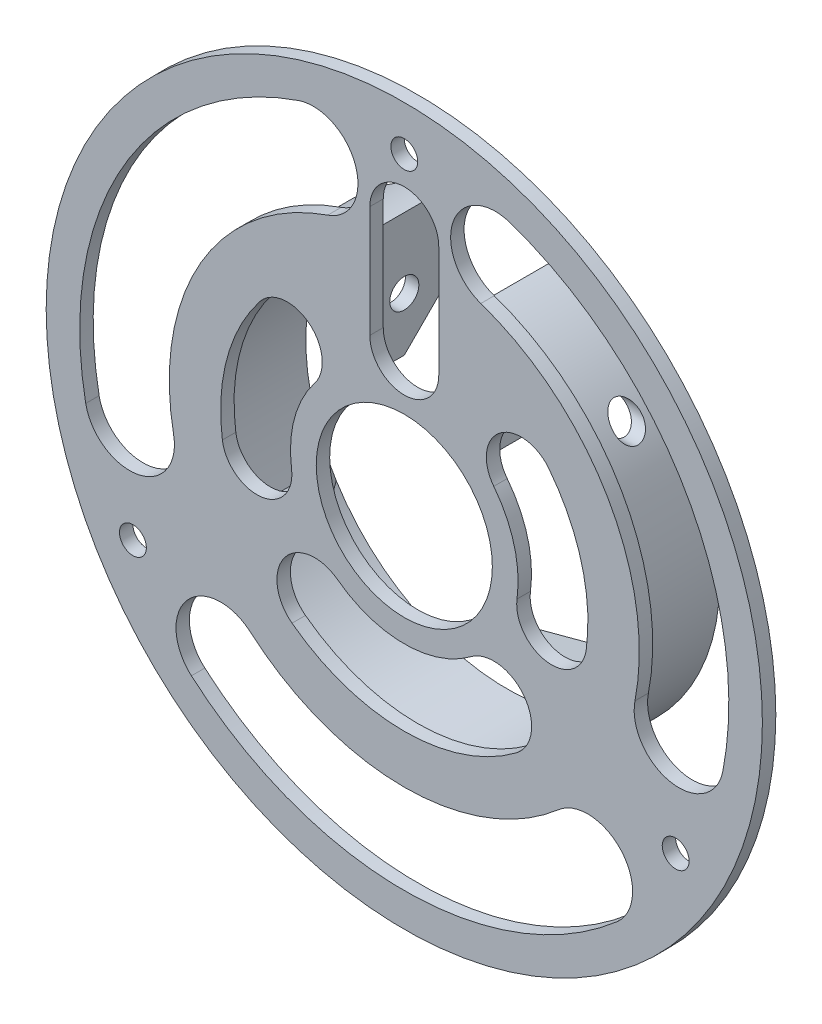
SolidWorks part; units mm, degrees
ref_plane "Plan de face" through (0, 0, 0) normal (0, 0, 1) x (1, 0, 0)
ref_plane "Plan de dessus" through (0, 0, 0) normal (0, 1, 0) x (1, 0, 0)
ref_plane "Plan de droite" through (0, 0, 0) normal (1, 0, 0) x (0, 0, -1)
sketch "Esquisse1" plane through (0, 0, 0) normal (0, 0, 1) x (1, 0, 0)
  circle A0 centre (0, 0) radius 47.5
  circle A1 centre (0, 0) radius 45
  dimension "D1" = 95
  dimension "D2" = 90
extrude "Boss.-Extru.1" add sketch "Esquisse1" along normal blind 20
sketch "Esquisse2" plane through (0, 0, 20) normal (0, 0, 1) x (1, 0, 0)
  circle A0 centre (0, 0) radius 80
  dimension "D1" = 160
extrude "Boss.-Extru.2" add sketch "Esquisse2" along normal blind 3
sketch "Esquisse3" plane through (0, 0, 20) normal (0, 0, -1) x (-1, 0, 0)
  line L0 (0, 0) -> (0, 80) construction
  circle A0 centre (0, 0) radius 80 construction
  circle A1 centre (0, 70) radius 3
  dimension "D1" = 6
  dimension "D2" = 70
extrude "Enlèv. mat.-Extru.2" cut sketch "Esquisse3" against normal blind 3
pattern_circular "Répétition circulaire1" count 3 over 360 about axis through (0, 0, 0) along (0, 0, 1) of "Enlèv. mat.-Extru.2"
sketch "Esquisse4" plane through (0, 0, 20) normal (0, 0, -1) x (-1, 0, 0)
  line L0 (0, 0) -> (0, 62.5) construction
  line L1 (0, 0) -> (60.6218, -35) construction
  line L2 (0, 0) -> (83.3652, 48.1309) construction
  circle A0 centre (0, 0) radius 62.5 construction
  arc A1 (20.3526, 59.0933) -> (61.3526, -11.9208) centre (0, 0) cw construction
  arc A2 (71.1691, -13.8281) -> (23.6091, 68.5483) centre (0, 0) ccw
  arc A3 (51.5362, -10.0134) -> (17.0962, 49.6384) centre (0, 0) ccw
  arc A4 (51.5362, -10.0134) -> (71.1691, -13.8281) centre (61.3526, -11.9208) ccw
  arc A5 (23.6091, 68.5483) -> (17.0962, 49.6384) centre (20.3526, 59.0933) ccw
  point P11 (54.1266, 31.25)
  dimension "D1" = 125
  dimension "D2" = 20
  dimension "D3" = 82
extrude "Enlèv. mat.-Extru.3" cut sketch "Esquisse4" against normal blind 3
pattern_circular "Répétition circulaire2" count 3 over 360 about axis through (0, 0, 0) along (0, 0, 1) of "Enlèv. mat.-Extru.3"
sketch "Esquisse5" plane through (0, 0, 20) normal (0, 0, -1) x (-1, 0, 0)
  line L0 (0, 0) -> (0, 70) construction
  line L2 (-13, 55.2993) -> (13, 55.2993)
  line L3 (-13, 55.2993) -> (-13, 35.9982)
  line L4 (-13, 35.9982) -> (13, 35.9982)
  line L5 (13, 55.2993) -> (13, 35.9982)
  dimension "D1" = 26
extrude "Enlèv. mat.-Extru.4" cut sketch "Esquisse5" along normal blind 57
sketch "Esquisse6" plane through (0, 0, 20) normal (0, 0, -1) x (-1, 0, 0)
  line L0 (0, 47.0037) -> (0, 28.2981) construction
  line L1 (-13, 43.0813) -> (-16, 43.0813)
  line L2 (-13, 43.0813) -> (-13, 18.0813)
  line L3 (-13, 18.0813) -> (-16, 18.0813)
  line L4 (-16, 43.0813) -> (-16, 18.0813)
  line L5 (16, 43.0813) -> (16, 18.0813)
  line L6 (13, 18.0813) -> (16, 18.0813)
  line L7 (13, 43.0813) -> (13, 18.0813)
  line L8 (13, 43.0813) -> (16, 43.0813)
  dimension "D1" = 3
  dimension "D2" = 25
extrude "Boss.-Extru.3" add sketch "Esquisse6" along normal blind 20
sketch "Esquisse7" plane through (-16, 0, 0) normal (-1, 0, 0) x (0, 0, 1)
  line L4 (50.7915, 0) -> (-69.2194, 0) construction
  point P8 (12.3348, 0)
  point P13 (-2.6652, 0)
  dimension "D1" = 15
sketch "Esquisse8" plane through (-16, 0, 0) normal (-1, 0, 0) x (0, 0, 1)
  line L0 (0, 30.0704) -> (18.0118, 30.0704) construction
  line L1 (0, 18.0813) -> (0, 42.0595) construction
  line L3 (20, 80) -> (20, -80) construction
  circle A0 centre (10, 30.0704) radius 3.25
  dimension "D1" = 6.5
  dimension "D2" = 10
extrude "Enlèv. mat.-Extru.5" cut sketch "Esquisse8" against normal through all
sketch "Esquisse9" plane through (0, 0, 20) normal (0, 0, -1) x (-1, 0, 0)
  line L0 (0, 0) -> (-60.6218, -35) construction
  line L1 (-20.879, -13.7865) -> (-22.379, -11.1885)
  line L2 (-22.379, -11.1885) -> (-39.6995, -21.1885)
  line L3 (-20.879, -13.7865) -> (-38.1995, -23.7865)
  line L4 (0, 0) -> (0, -35) construction
  line L5 (20.879, -13.7865) -> (38.1995, -23.7865)
  line L6 (22.379, -11.1885) -> (39.6995, -21.1885)
  line L7 (20.879, -13.7865) -> (22.379, -11.1885)
  arc A0 (-16, 42.0595) -> (16, 42.0595) centre (0, 0) ccw construction
  arc A1 (-39.6995, -21.1885) -> (-38.1995, -23.7865) centre (0, 0) ccw
  arc A2 (39.6995, -21.1885) -> (38.1995, -23.7865) centre (0, 0) cw
  point P8 (-21.629, -12.4875)
  point P14 (21.629, -12.4875)
  dimension "D1" = 3
  dimension "D2" = 20
extrude "Boss.-Extru.4" add sketch "Esquisse9" along normal blind 20
chamfer "Chanfrein1" distance 20 angle 45 2 edges at (-21.629, -12.4875, 0) (21.629, -12.4875, 0)
chamfer "Chanfrein3" distance 10 angle 45 2 edges at (-14.5, 18.0813, 0) (14.5, 18.0813, 0)
sketch "Esquisse10" plane through (0, 0, 20) normal (0, 0, -1) x (-1, 0, 0)
  line L0 (0, 0) -> (0, 44.892) construction
  line L1 (0, 31.0717) -> (0, 55.9777) construction
  line L2 (-7.7006, 31.0717) -> (-7.7006, 55.9777)
  line L3 (7.7006, 31.0717) -> (7.7006, 55.9777)
  arc A0 (32.9128, -4.564) -> (26.1236, 20.5339) centre (0, 0) ccw construction
  circle A1 centre (0, 0) radius 33.2277 construction
  arc A2 (-32.9128, -4.564) -> (-26.1236, 20.5339) centre (0, 0) cw construction
  arc A3 (-32.2552, 25.3535) -> (-40.638, -5.6353) centre (0, 0) ccw
  arc A4 (-19.9919, 15.7143) -> (-25.1876, -3.4928) centre (0, 0) ccw
  arc A5 (-19.9919, 15.7143) -> (-32.2552, 25.3535) centre (-26.1236, 20.5339) ccw
  arc A6 (-40.638, -5.6353) -> (-25.1876, -3.4928) centre (-32.9128, -4.564) ccw
  arc A7 (32.2552, 25.3535) -> (40.638, -5.6353) centre (0, 0) cw
  arc A8 (19.9919, 15.7143) -> (25.1876, -3.4928) centre (0, 0) cw
  arc A9 (19.9919, 15.7143) -> (32.2552, 25.3535) centre (26.1236, 20.5339) cw
  arc A10 (40.638, -5.6353) -> (25.1876, -3.4928) centre (32.9128, -4.564) cw
  arc A11 (-19.9919, -26.5406) -> (19.9919, -26.5406) centre (0, 0) ccw construction
  arc A12 (-25.0803, -33.2958) -> (25.0803, -33.2958) centre (0, 0) ccw
  arc A13 (-14.9035, -19.7854) -> (14.9035, -19.7854) centre (0, 0) ccw
  arc A14 (-14.9035, -19.7854) -> (-25.0803, -33.2958) centre (-19.9919, -26.5406) ccw
  arc A15 (25.0803, -33.2958) -> (14.9035, -19.7854) centre (19.9919, -26.5406) ccw
  circle A16 centre (0, 0) radius 19.6695
  arc A17 (-7.7006, 31.0717) -> (7.7006, 31.0717) centre (0, 31.0717) ccw
  arc A18 (7.7006, 55.9777) -> (-7.7006, 55.9777) centre (0, 55.9777) ccw
  point P7 (-32.0749, 8.6765)
  point P14 (32.0749, 8.6765)
  point P22 (0, -33.2277)
  point P30 (0, 43.5247)
  dimension "D1" = 26
extrude "Enlèv. mat.-Extru.6" cut sketch "Esquisse10" against normal blind 20
